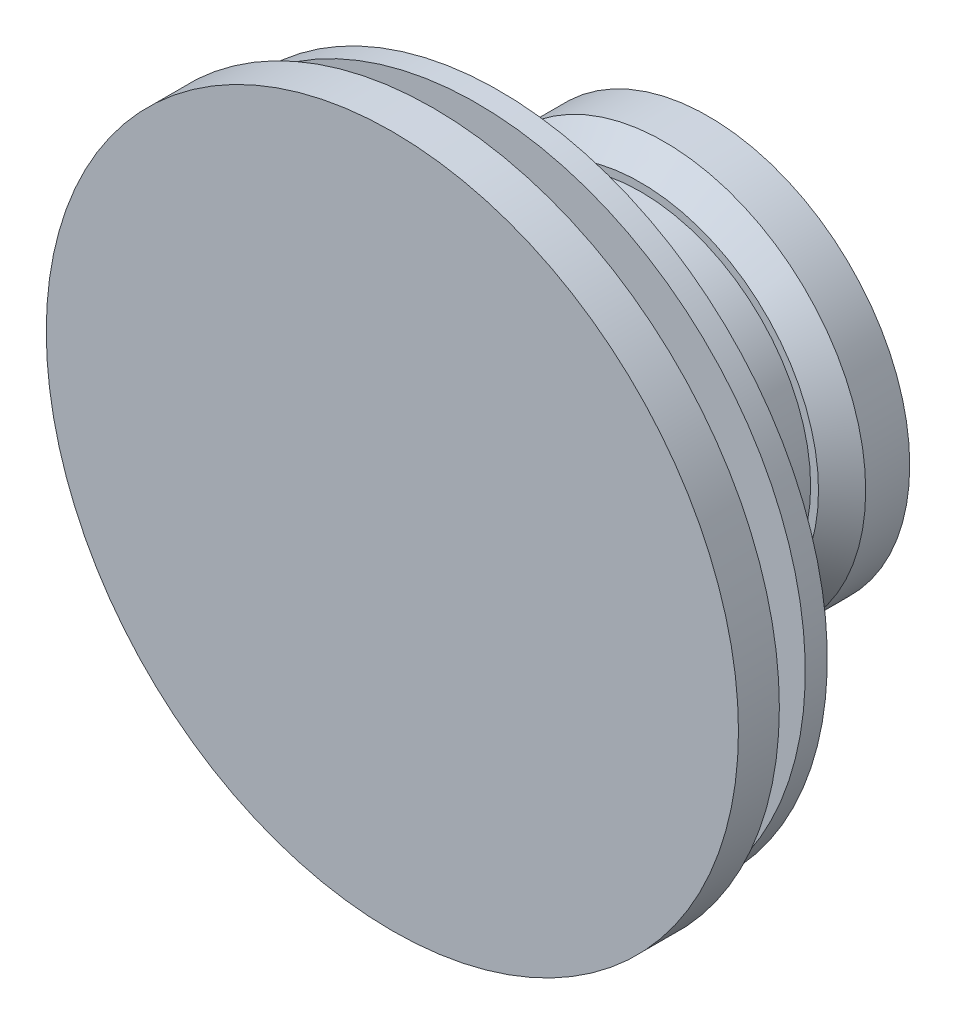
SolidWorks part; units mm, degrees
ref_plane "Front Plane" through (0, 0, 0) normal (0, 0, 1) x (1, 0, 0)
ref_plane "Top Plane" through (0, 0, 0) normal (0, 1, 0) x (1, 0, 0)
ref_plane "Right Plane" through (0, 0, 0) normal (1, 0, 0) x (0, 0, -1)
other "Center of Mass"
sketch "Sketch1" plane through (0, 0, 0) normal (0, 1, 0) x (1, 0, 0)
  line L0 (0, 0) -> (27.94, 0)
  line L1 (27.94, 0) -> (27.94, 3.302)
  line L2 (27.94, 3.302) -> (24.13, 3.302)
  line L3 (24.13, 3.302) -> (24.13, 4.302)
  line L4 (24.13, 4.302) -> (22.0472, 4.302)
  line L5 (22.0472, 4.302) -> (22.0472, 6.842)
  line L6 (22.0472, 6.842) -> (26.4922, 6.842)
  line L7 (26.4922, 6.842) -> (26.4922, 8.62)
  line L8 (26.4922, 8.62) -> (13.716, 8.62)
  line L9 (13.716, 8.62) -> (13.716, 20.05)
  line L10 (13.716, 20.05) -> (14.351, 20.05)
  line L11 (14.351, 20.05) -> (16.256, 21.955)
  line L12 (16.256, 21.955) -> (16.256, 25.511)
  line L13 (16.256, 25.511) -> (15.256, 25.5117)
  line L14 (15.256, 25.5117) -> (15.256, 25.0037)
  line L15 (15.256, 25.0037) -> (12.208, 23.2439)
  line L16 (0, 0) -> (0, -35.1844) construction
  line L17 (0, 0) -> (0, 24.5056)
  arc A1 (12.208, 23.2439) -> (0, 24.5056) centre (0, -35.1844) ccw
  point P20 (0, 12.2528)
  dimension "D19" = 59.69
  dimension "D1" = 27.94
  dimension "D2" = 3.302
  dimension "D3" = 1
  dimension "D4" = 4.445
  dimension "D5" = 1.778
  dimension "D6" = 2.54
  dimension "D7" = 26.4922
  dimension "D8" = 24.13
  dimension "D9" = 13.716
  dimension "D10" = 16.256
  dimension "D11" = 135
  dimension "D12" = 5.461
  dimension "D13" = 11.43
  dimension "D14" = 1
  dimension "D15" = 120
  dimension "D16" = 0.508
  dimension "D17" = 1.016
  dimension "D18" = 3.048
  dimension "D20" = 1.905
revolve "Revolve1" add sketch "Sketch1" angle 360 about L16
sketch "Sketch2" plane through (0, 0, -8.62) normal (0, 0, -1) x (-1, 0, 0)
  line L0 (0, 0) -> (0, -21.9351) construction
  text T0 "25mm"
extrude "Cut-Extrude1" cut sketch "Sketch2" against normal blind 0.254
sketch "Sketch3" plane through (0, 0, 0) normal (0, 1, 0) x (1, 0, 0)
  point P0 (-16.256, 25.511)
  point P1 (16.256, 25.511)
